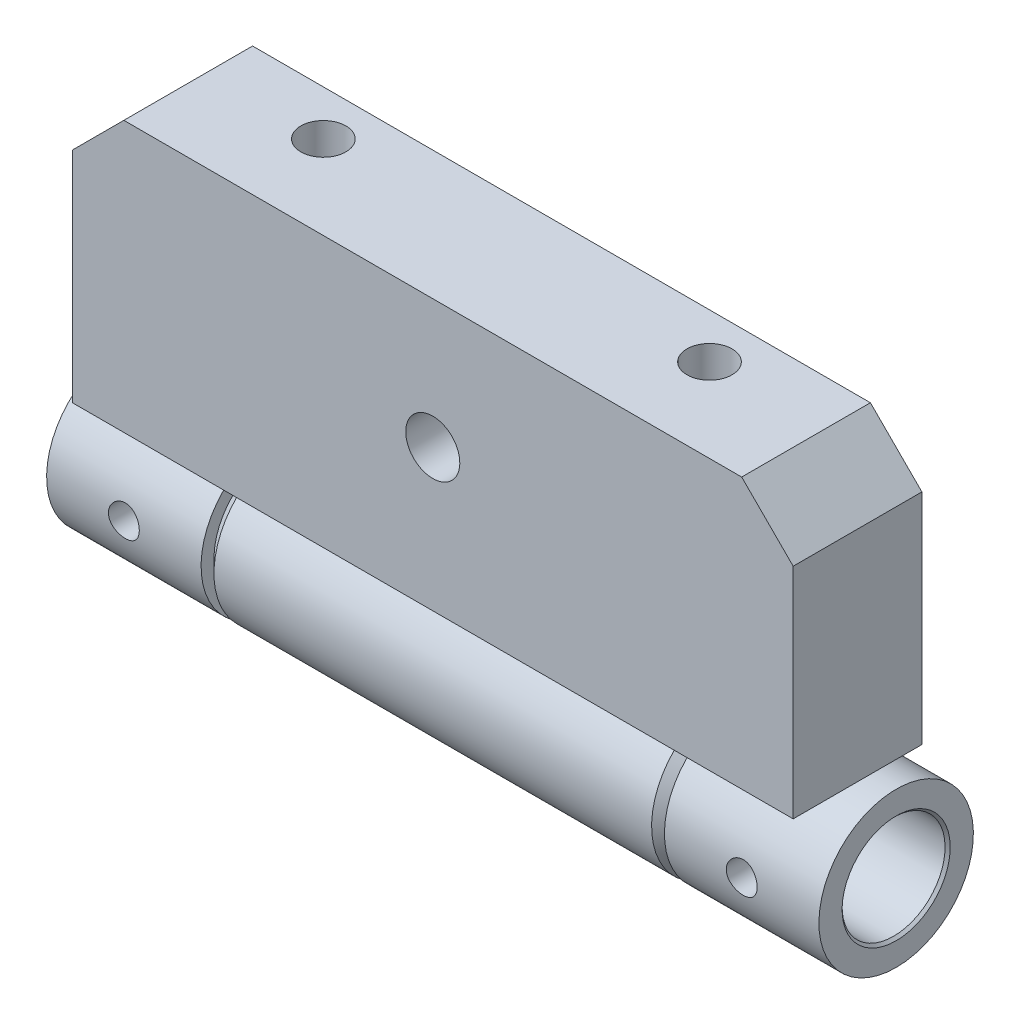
SolidWorks part; units mm, degrees
ref_plane "Längs" through (0, 0, 0) normal (0, 0, 1) x (1, 0, 0)
ref_plane "Oben" through (0, 0, 0) normal (0, 1, 0) x (1, 0, 0)
ref_plane "Quer" through (0, 0, 0) normal (1, 0, 0) x (0, 0, -1)
sketch "Basis" plane through (0, 0, 0) normal (0, 0, 1) x (1, 0, 0)
  line L0 (90, 0) -> (-90, 0)
  line L1 (-90, 0) -> (-150, 0)
  line L5 (90, 0) -> (150, 0)
  point P2 (0, 0)
  dimension "D1" = 60
  dimension "D2" = 300
other "D60x9"
ref_plane "Ebene1" through (90, 0, 0) normal (-1, 0, 0) x (0, -1, 0)
sketch "Skizze110" plane through (90, 0, 0) normal (-1, 0, 0) x (0, -1, 0)
  line L0 (0, 30) -> (0, -30) construction
  line L1 (-30, 0) -> (30, 0) construction
  line L3 (-30, 30) -> (30, 30) construction
  line L4 (-30, 30) -> (-30, -30) construction
  line L5 (-30, -30) -> (30, -30) construction
  line L6 (30, 30) -> (30, -30) construction
  circle A0 centre (0, 0) radius 30
  circle A1 centre (0, 0) radius 21
  point P12 (0, 0)
  dimension "Dm" = 60
  dimension "s" = 9
sketch "Skizze13" plane through (-90, 0, 0) normal (-1, 0, 0) x (0, 0, 1)
  circle A0 centre (0, 0) radius 30 construction
  circle A1 centre (0, 0) radius 30
  circle A2 centre (0, 0) radius 20
  dimension "D1" = 40
extrude "Linear austragen1" add sketch "Skizze13" along normal blind 60 separate body
chamfer "Fase1" distance 1 angle 45 1 edges at (-150, -20, 0)
mirror "Spiegeln1" about plane through (0, 0, 0) normal (1, 0, 0)
sketch "Skizze17" plane through (0, 0, 0) normal (1, 0, 0) x (0, 0, -1)
  line L0 (-30, 0) -> (-30, 30) construction
  line L1 (-30, 135) -> (20, 135)
  line L2 (-30, 135) -> (-30, 30)
  line L3 (-30, 30) -> (20, 30)
  line L4 (20, 135) -> (20, 30)
  line L5 (0, 0) -> (-30, 0) construction
  circle A1 centre (0, 0) radius 30 construction
  dimension "D1" = 50
  dimension "D2" = 105
extrude "Linear austragen2" add sketch "Skizze17" along normal mid plane 280 separate body
sketch "Skizze18" plane through (0, 0, -20) normal (0, 0, -1) x (-1, 0, 0)
  line L0 (0, 0) -> (0, 85) construction
  circle A0 centre (0, 85) radius 25
  dimension "D2" = 50
  dimension "D1" = 85
extrude "Linear austragen3" cut sketch "Skizze18" against normal blind 20
hole_wizard "Ø12.0 (12) Durchmesser Bohrung1" positions "Skizze16" profile "Skizze15" hole size "Ø12.0" standard "ISO_Wehrhahn"
sketch "Skizze16" plane through (60.9377, 94.3804, 30) normal (0, 0, 1) x (1, 0, 0)
  line L0 (59.0623, -94.3804) -> (-180.9377, -94.3804) construction
  point P0 (-180.9377, -94.3804)
  point P1 (59.0623, -94.3804)
  point P9 (-60.9377, -94.3804)
  dimension "D1" = 240
sketch "Skizze15" plane through (-120, 0, 30) normal (1, 0, 0) x (0, -1, 0)
  line L0 (0, 0) -> (0, 73.6052)
  line L1 (0, 73.6052) -> (6, 70)
  line L2 (6, 70) -> (6, 0)
  line L5 (6, 0) -> (0, 0)
  line L10 (0, 73.6052) -> (-6, 70) construction
  line L11 (0, -6.35) -> (0, 107.95) construction
  dimension "Bohrerdurchmesser" = 12
  dimension "Bohrungstiefe" = 70
  dimension "Spitzenwinkel" = 118
hole_wizard "M24 Gewindebohrung1" positions "Skizze20" profile "Skizze19" tap size "M24" standard "ISO_Wehrhahn"
sketch "Skizze20" plane through (0, 0, 0) normal (0, 0, -1) x (-1, 0, 0)
  point P0 (0, 85)
sketch "Skizze19" plane through (0, 85, 0) normal (1, 0, 0) x (0, 1, 0)
  line L0 (0, 0) -> (0, 69.309)
  line L1 (0, 69.309) -> (10.5, 63)
  line L2 (10.5, 63) -> (10.5, 0)
  line L5 (10.5, 0) -> (0, 0)
  line L10 (0, 69.309) -> (-10.5, 63) construction
  line L11 (0, -6.35) -> (0, 107.95) construction
  dimension "Bohrerdurchmesser" = 21
  dimension "Bohrungstiefe" = 63
  dimension "Spitzenwinkel" = 118
hole_wizard "M20 Gewindebohrung1" positions "Skizze22" profile "Skizze21" tap size "M20" standard "ISO_Wehrhahn"
sketch "Skizze22" plane through (0, 135, 0) normal (0, 1, 0) x (-1, 0, 0)
  line L0 (75, -2.5) -> (-75, -2.5) construction
  line L2 (0, 0) -> (0, -2.5) construction
  line L4 (-140, 30) -> (140, 30) construction
  point P0 (75, -2.5)
  point P1 (-75, -2.5)
  dimension "D1" = 32.5
  dimension "D2" = 150
sketch "Skizze21" plane through (-75, 135, -2.5) normal (1, 0, 0) x (0, 0, 1)
  line L0 (0, 0) -> (0, 57.7575)
  line L1 (0, 57.7575) -> (8.75, 52.5)
  line L2 (8.75, 52.5) -> (8.75, 0)
  line L5 (8.75, 0) -> (0, 0)
  line L10 (0, 57.7575) -> (-8.75, 52.5) construction
  line L11 (0, -6.35) -> (0, 107.95) construction
  dimension "Bohrerdurchmesser" = 17.5
  dimension "Bohrungstiefe" = 52.5
  dimension "Spitzenwinkel" = 118
chamfer "Fase2" distance 20 angle 45 2 edges at (140, 135, 5) (-140, 135, 5)
chamfer "Fase3" distance 5 angle 45 2 edges at (-90, -30, 0) (90, -30, 0)
